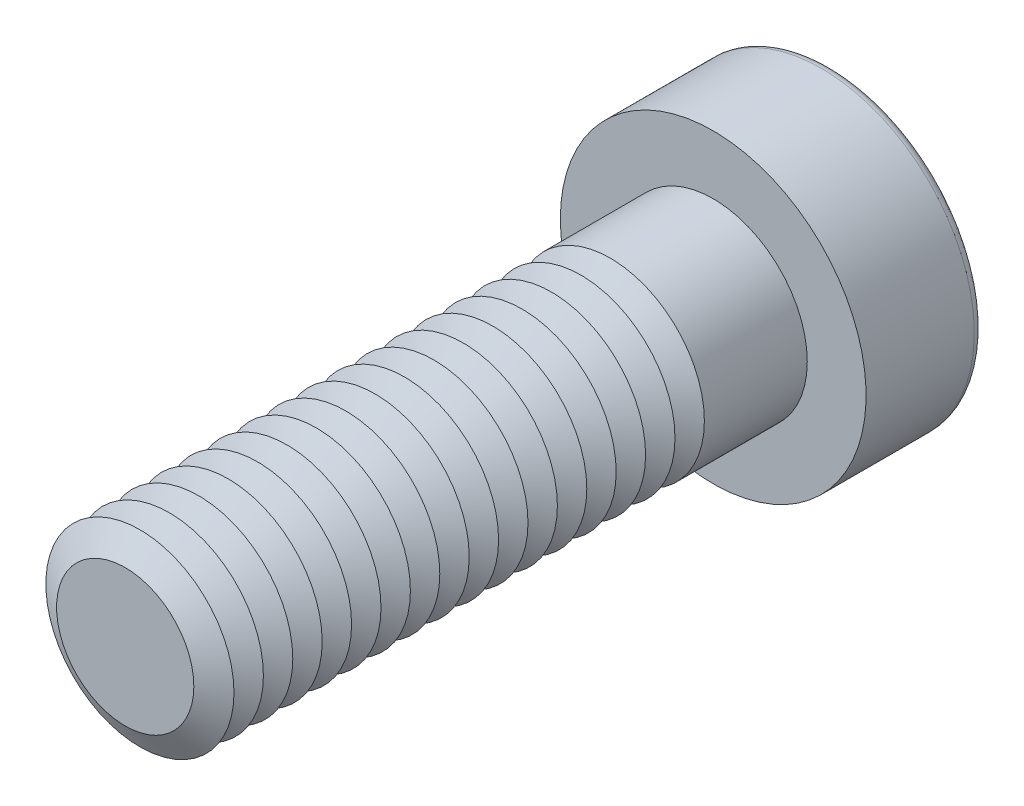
SolidWorks part; units mm, degrees
ref_plane "Front Plane" through (0, 0, 0) normal (0, 0, 1) x (1, 0, 0)
ref_plane "Top Plane" through (0, 0, 0) normal (0, 1, 0) x (1, 0, 0)
ref_plane "Right Plane" through (0, 0, 0) normal (1, 0, 0) x (0, 0, -1)
sketch "Sketch1" plane through (0, 0, 0) normal (0, 0, 1) x (1, 0, 0)
  circle A0 centre (0, 0) radius 4
  dimension "D1" = 8
extrude "Boss-Extrude1" add sketch "Sketch1" along normal blind 25
sketch "Sketch2" plane through (0, 0, 0) normal (0, 0, -1) x (-1, 0, 0)
  circle A0 centre (0, 0) radius 6.5
  dimension "D1" = 13
extrude "Boss-Extrude2" add sketch "Sketch2" along normal blind 5
sketch "Sketch3" plane through (0, 0, -5) normal (0, 0, -1) x (-1, 0, 0)
  line L1 (-1.4434, 2.5) -> (-2.8868, 0)
  line L2 (-2.8868, 0) -> (-1.4434, -2.5)
  line L3 (-1.4434, -2.5) -> (1.4434, -2.5)
  line L4 (1.4434, -2.5) -> (2.8868, 0)
  line L5 (2.8868, 0) -> (1.4434, 2.5)
  line L6 (1.4434, 2.5) -> (-1.4434, 2.5)
  circle A0 centre (0, 0) radius 2.5 construction
  dimension "D1" = 5
extrude "Cut-Extrude1" cut sketch "Sketch3" against normal blind 3.75
fillet "Fillet1" radius 0.4 1 edges at (-6.5, 0, -5)
sketch "Sketch4" plane through (0, 0, -1.25) normal (0, 0, -1) x (-1, 0, 0)
  line L0 (1.4434, -2.5) -> (2.8868, 0) construction
  circle A0 centre (0, 0) radius 2.5
extrude "Cut-Extrude2" cut sketch "Sketch4" against normal through all draft 60
sketch "Sketch5" plane through (0, 0, -5) normal (0, 0, -1) x (-1, 0, 0)
  circle A0 centre (0, 0) radius 2.8868
extrude "Cut-Extrude3" cut sketch "Sketch5" against normal through all draft 75
sketch "Sketch7" plane through (0, 0, 0) normal (1, 0, 0) x (0, 0, -1)
  line L25 (-25, 2.9175) -> (-24.375, 4)
  line L26 (-25, 4) -> (-25, -4) construction
  line L27 (-24.375, 4) -> (-25.625, 4)
  line L28 (-25.625, 4) -> (-25, 2.9175)
  line L29 (0, 4) -> (-25, 4) construction
  dimension "D1" = 1.25
revolve "Cut-Revolve1" cut sketch "Sketch7" angle 360 about axis through (0, 0, 25) along (0, 0, -1)
pattern_linear "LPattern1" count 17 spacing 1.25 along (0, 0, -1) of "Cut-Revolve1"
